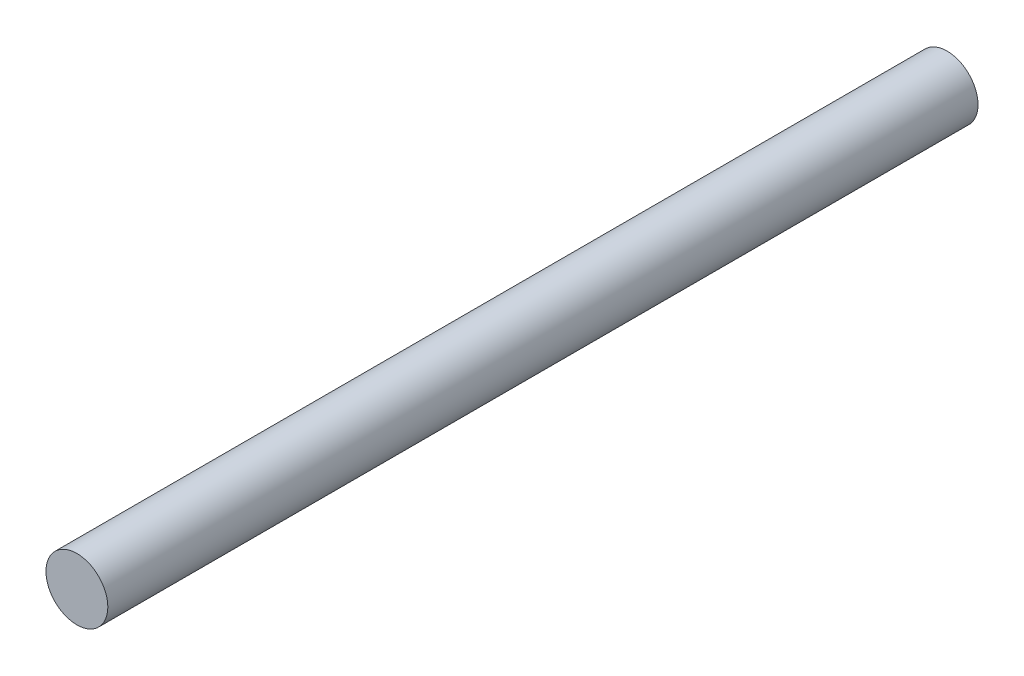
SolidWorks part; units mm, degrees
ref_plane "Plan de face" through (0, 0, 0) normal (0, 0, 1) x (1, 0, 0)
ref_plane "Plan de dessus" through (0, 0, 0) normal (0, 1, 0) x (1, 0, 0)
ref_plane "Plan de droite" through (0, 0, 0) normal (1, 0, 0) x (0, 0, -1)
sketch "Esquisse1" plane through (0, 0, 0) normal (0, 0, 1) x (1, 0, 0)
  circle A0 centre (0, 0) radius 16
  dimension "D1" = 32
extrude "Extrusion1" add sketch "Esquisse1" along normal blind 450
